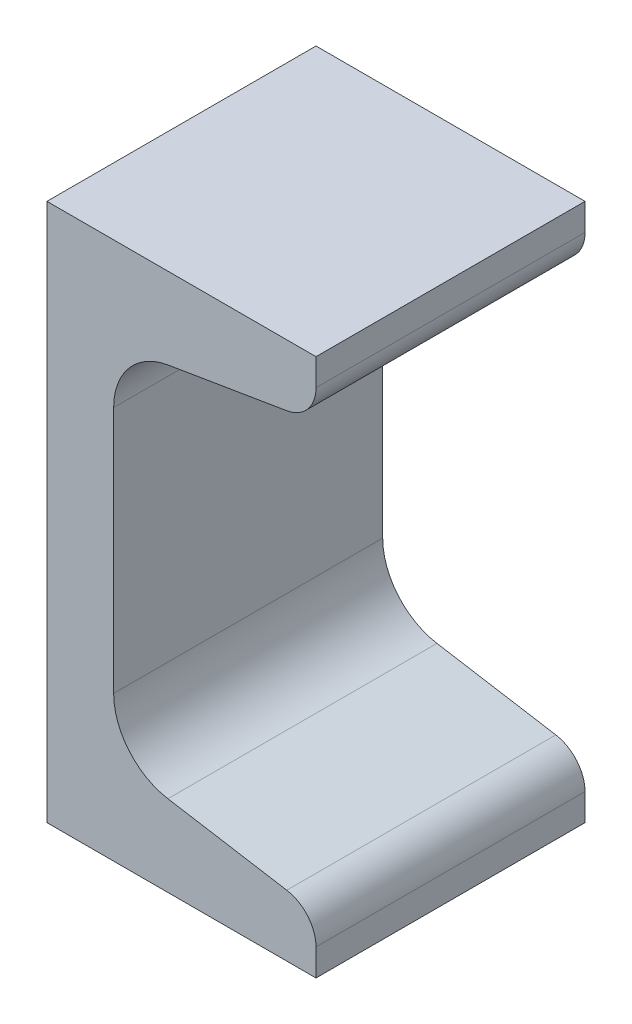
SolidWorks part; units mm, degrees
ref_plane "Plane1" through (0, 0, 0) normal (0, 0, 1) x (1, 0, 0)
ref_plane "Plane2" through (0, 0, 0) normal (0, 1, 0) x (-1, 0, 0)
ref_plane "Plane3" through (0, 0, 0) normal (1, 0, 0) x (0, 0, -1)
other "Configuration Table"
sketch "Sketch1" plane through (0, 0, 0) normal (0, 0, 1) x (1, 0, 0)
  line L0 (0, 0) -> (0, 50.8)
  line L1 (0, 50.8) -> (25.4, 50.8)
  line L2 (0, 0) -> (25.4, 0)
  line L3 (7.8492, 0) -> (-7.8492, 0) construction
  line L4 (0, -15.6984) -> (0, 15.6984) construction
  line L12 (6.2965, 37.0849) -> (6.2965, 13.7151)
  line L15 (25.4, 50.8) -> (25.4, 48.26)
  line L16 (25.4, 0) -> (25.4, 2.54)
  line L17 (11.4196, 43.1326) -> (22.6409, 45.0029)
  line L18 (11.4196, 7.6674) -> (22.6409, 5.7971)
  arc A9 (6.2965, 13.7151) -> (11.4196, 7.6674) centre (12.4276, 13.7151) ccw
  arc A10 (6.2965, 37.0849) -> (11.4196, 43.1326) centre (12.4276, 37.0849) cw
  arc A11 (25.4, 48.26) -> (22.6409, 45.0029) centre (22.098, 48.26) cw
  arc A12 (25.4, 2.54) -> (22.6409, 5.7971) centre (22.098, 2.54) ccw
  dimension "RI" = 6.1311
  dimension "D2" = 9.463
  dimension "RA" = 3.302
  dimension "DEPTH" = 50.8
  dimension "BF" = 25.4
  dimension "TW" = 6.2965
  dimension "d1" = 23.3698
extrude "BaseAlumChannel" add sketch "Sketch1" along normal mid plane 25.4
